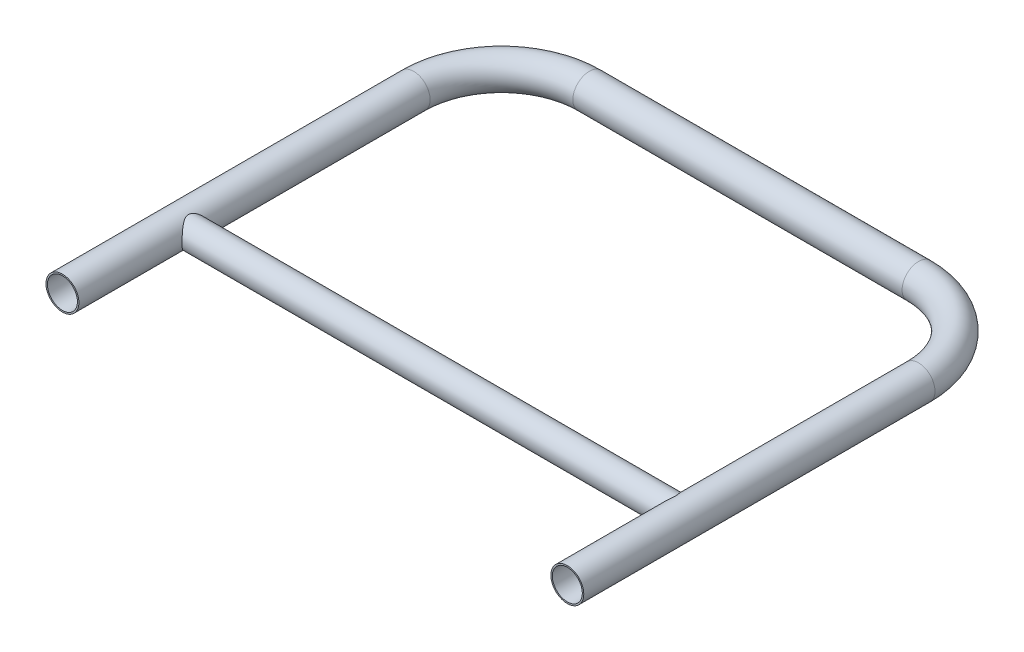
SolidWorks part; units mm, degrees
ref_plane "Plan de face" through (0, 0, 0) normal (0, 0, 1) x (1, 0, 0)
ref_plane "Plan de dessus" through (0, 0, 0) normal (0, 1, 0) x (1, 0, 0)
ref_plane "Plan de droite" through (0, 0, 0) normal (1, 0, 0) x (0, 0, -1)
sketch "Esquisse1" plane through (0, 0, 0) normal (0, 0, 1) x (1, 0, 0)
  circle A0 centre (0, 0) radius 22.5
  circle A1 centre (0, 0) radius 20.5
  dimension "D1" = 45
  dimension "D2" = 2
sketch "Esquisse2" plane through (0, 0, 0) normal (0, 1, 0) x (1, 0, 0)
  line L0 (0, 0) -> (0, 480)
  line L1 (120, 600) -> (570, 600)
  line L2 (690, 480) -> (690, 0)
  arc A0 (0, 480) -> (120, 600) centre (120, 480) cw
  arc A1 (570, 600) -> (690, 480) centre (570, 480) cw
  point P7 (0, 600)
  point P10 (690, 600)
  dimension "D3" = 120
  dimension "D1" = 600
  dimension "D2" = 690
sweep "Balayage1" add profiles "Esquisse1" path "Esquisse2"
ref_plane "Plan1" through (345, 0, 0) normal (1, 0, 0) x (0, 0, -1)
sketch "Esquisse3" plane through (345, 0, 0) normal (1, 0, 0) x (0, 0, -1)
  line L0 (0, 0) -> (71.5199, 0) construction
  circle A0 centre (160, 0) radius 19
  dimension "D2" = 38
  dimension "D1" = 160
extrude "Extru.-Mince1" add sketch "Esquisse3" along normal up to next and the other way up to next thin
